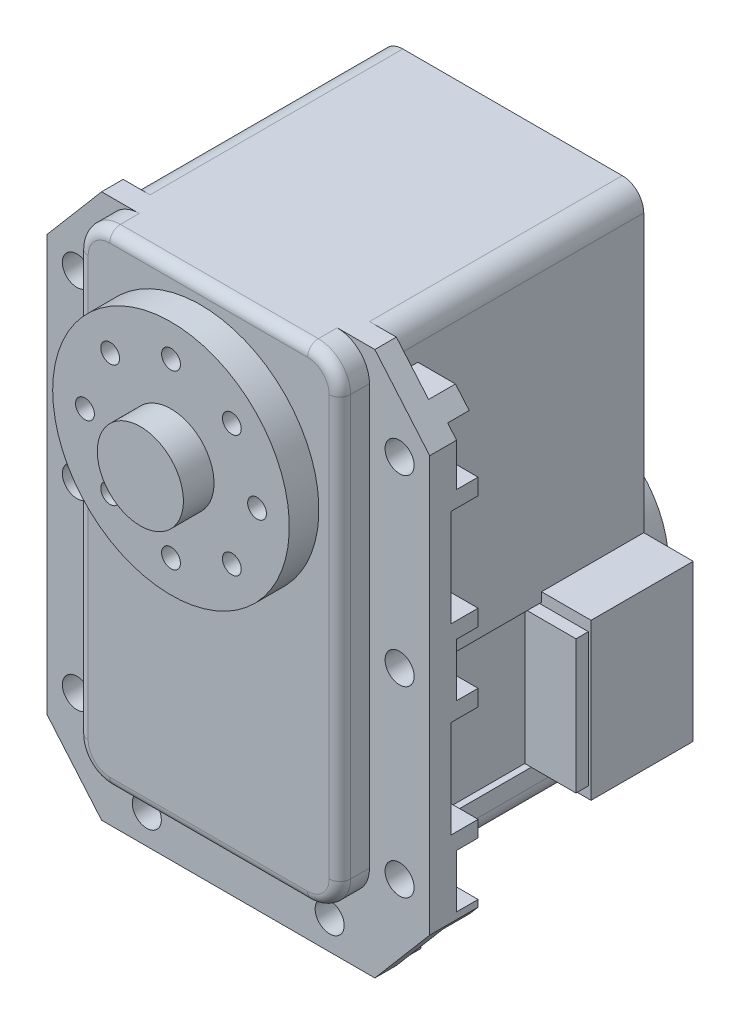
SolidWorks part; units mm, degrees
other "Solid1"
ref_plane "Front Plane" through (0, 0, 0) normal (0, 0, 1) x (1, 0, 0)
ref_plane "Top Plane" through (0, 0, 0) normal (0, 1, 0) x (1, 0, 0)
ref_plane "Right Plane" through (0, 0, 0) normal (1, 0, 0) x (0, 0, -1)
imported_body "Imported1"
sketch "Sketch1" plane through (0, 0, -15) normal (0, 0, -1) x (-1, 0, 0)
  line L0 (12.7, -38.6) -> (-12.7, -38.6) construction
  line L1 (-17.8, 12) -> (17.8, 12)
  line L2 (-17.8, 12) -> (-17.8, -38.6)
  line L3 (-17.8, -38.6) -> (17.8, -38.6)
  line L4 (17.8, 12) -> (17.8, -38.6)
  line L5 (17.8, 6) -> (17.8, -32.6) construction
  line L6 (-17.8, -32.6) -> (-17.8, 6) construction
  line L7 (6.2267, 12) -> (12.7, 12) construction
extrude "Cut-Extrude1" cut sketch "Sketch1" against normal offset from surface 25.5 and the other way through all
sketch "Sketch2" plane through (0, 0, -10.5) normal (0, 0, -1) x (-1, 0, 0)
  line L0 (0, 0) -> (0, -33) construction
  line L1 (10.2, -33) -> (-10.2, -33) construction
  circle A0 centre (0, -23) radius 8.5
  dimension "D1" = 17
  dimension "D2" = 10
extrude "Boss-Extrude1" add sketch "Sketch2" along normal blind 6
sketch "Sketch3" plane through (0, 0, -10.5) normal (0, 0, -1) x (-1, 0, 0)
  line L0 (0, -33) -> (0, 12) construction
  line L1 (10.2, -33) -> (-10.2, -33) construction
  line L2 (10.2, 12) -> (-10.2, 12) construction
  line L3 (0, -10.5) -> (-21.8788, -10.5) construction
  circle A0 centre (9.25, -30) radius 1.375
  circle A1 centre (-9.25, -30) radius 1.375
  circle A2 centre (9.25, 9) radius 1.375
  circle A3 centre (-9.25, 9) radius 1.375
  dimension "D1" = 18.5
  dimension "D2" = 39
  dimension "D3" = 2.75
extrude "Cut-Extrude2" cut sketch "Sketch3" against normal up to surface (21 mm away)
sketch "Sketch4" plane through (0, 0, 21.25) normal (0, 0, 1) x (1, 0, 0)
  line L0 (0, -11) -> (0, 11) construction
  circle A0 centre (0, 0) radius 11 construction
  circle A1 centre (0, -8) radius 0.875
  circle A2 centre (0, 0) radius 2.25 construction
  circle A3 centre (-5.6569, -5.6569) radius 0.875
  circle A4 centre (-8, 0) radius 0.875
  circle A5 centre (-5.6569, 5.6569) radius 0.875
  circle A6 centre (0, 8) radius 0.875
  circle A7 centre (5.6569, 5.6569) radius 0.875
  circle A8 centre (8, 0) radius 0.875
  circle A9 centre (5.6569, -5.6569) radius 0.875
  point P25 (0, 0)
  dimension "D1" = 1.75
  dimension "D2" = 8
  dimension "D3" = 8
extrude "Cut-Extrude3" cut sketch "Sketch4" against normal up to surface (3.5 mm away)
sketch "Sketch5" plane through (0, 0, 24.1) normal (0, 0, 1) x (1, 0, 0)
  circle A0 centre (0, 0) radius 2.25 construction
  circle A1 centre (0, 0) radius 2.25
extrude "Cut-Extrude4" cut sketch "Sketch5" along normal through all
